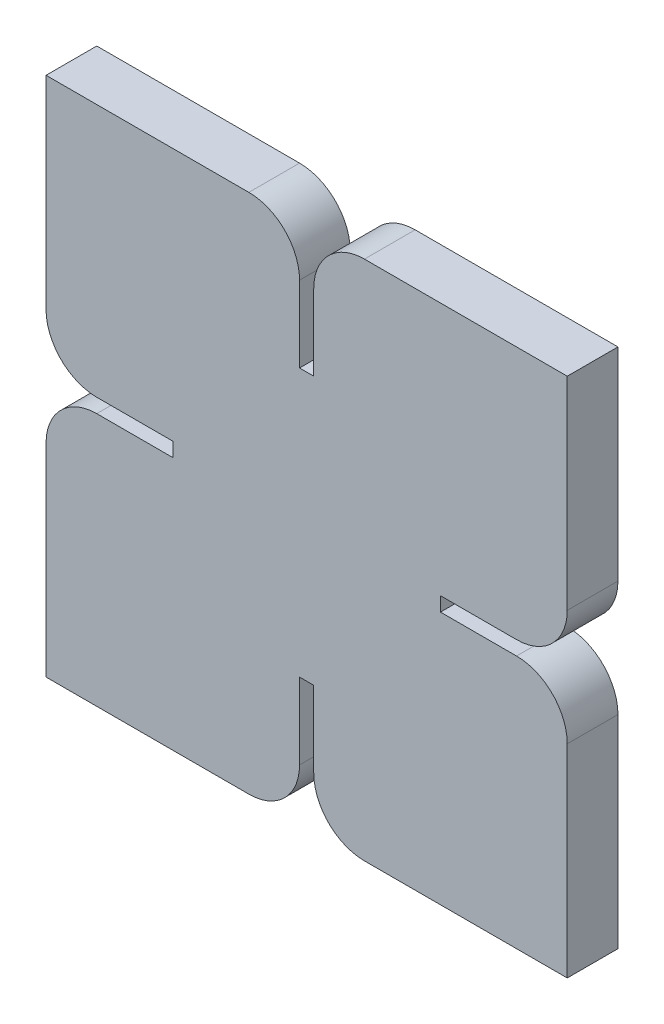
SolidWorks part; units mm, degrees
ref_plane "Front Plane" through (0, 0, 0) normal (0, 0, 1) x (1, 0, 0)
ref_plane "Top Plane" through (0, 0, 0) normal (0, 1, 0) x (1, 0, 0)
ref_plane "Right Plane" through (0, 0, 0) normal (1, 0, 0) x (0, 0, -1)
sketch "Sketch1" plane through (0, 0, 0) normal (0, 0, 1) x (1, 0, 0)
  line L0 (0, 56.5994) -> (0, -33.9185) construction
  line L1 (1.4, 26.4) -> (1.4, 41.4)
  line L2 (-26.4, 1.4) -> (-26.4, -1.4)
  line L3 (-1.4, 26.4) -> (1.4, 26.4)
  line L4 (51.4, 51.4) -> (11.4, 51.4)
  line L5 (51.4, 11.4) -> (51.4, 51.4)
  line L6 (41.4, 1.4) -> (26.4, 1.4)
  line L7 (-41.4, 1.4) -> (-26.4, 1.4)
  line L8 (-51.4, 11.4) -> (-51.4, 51.4)
  line L9 (-51.4, 51.4) -> (-11.4, 51.4)
  line L10 (-1.4, 26.4) -> (-1.4, 41.4)
  line L11 (26.4, 1.4) -> (26.4, -1.4)
  line L12 (-1.4, -26.4) -> (-1.4, -41.4)
  line L13 (-51.4, -51.4) -> (-11.4, -51.4)
  line L14 (-51.4, -11.4) -> (-51.4, -51.4)
  line L15 (-41.4, -1.4) -> (-26.4, -1.4)
  line L16 (41.4, -1.4) -> (26.4, -1.4)
  line L17 (51.4, -11.4) -> (51.4, -51.4)
  line L18 (51.4, -51.4) -> (11.4, -51.4)
  line L19 (-47.3502, 0) -> (63.8446, 0) construction
  line L20 (-1.4, -26.4) -> (1.4, -26.4)
  line L21 (1.4, -26.4) -> (1.4, -41.4)
  arc A0 (-1.4, 41.4) -> (-11.4, 51.4) centre (-11.4, 41.4) ccw
  arc A1 (41.4, 1.4) -> (51.4, 11.4) centre (41.4, 11.4) ccw
  arc A2 (1.4, 41.4) -> (11.4, 51.4) centre (11.4, 41.4) cw
  arc A3 (-41.4, -1.4) -> (-51.4, -11.4) centre (-41.4, -11.4) ccw
  arc A4 (1.4, -41.4) -> (11.4, -51.4) centre (11.4, -41.4) ccw
  arc A5 (41.4, -1.4) -> (51.4, -11.4) centre (41.4, -11.4) cw
  arc A6 (-41.4, 1.4) -> (-51.4, 11.4) centre (-41.4, 11.4) cw
  arc A7 (-1.4, -41.4) -> (-11.4, -51.4) centre (-11.4, -41.4) cw
  point P0 (0, 0)
  point P3 (-1.4, 51.4)
  point P10 (-156.0365, -11.2807)
  point P12 (-156.0365, -11.2807)
  point P13 (-133.044, -4.2512)
  point P18 (-121.9935, -11.2807)
  point P27 (0, 26.4)
  point P29 (51.4, 1.4)
  point P30 (51.4, -1.4)
  point P44 (26.4, 0)
  point P47 (-51.4, -1.4)
  point P50 (-51.4, 1.4)
  point P53 (1.4, 51.4)
  point P54 (-26.4, 0)
  point P55 (1.4, -51.4)
  point P56 (0, -26.4)
  point P57 (-1.4, -51.4)
extrude "Boss-Extrude1" add sketch "Sketch1" along normal blind 10
equation "\"D1@Sketch1\"=\"A\""
equation "\"A\" = 50"
equation "\"D2@Sketch1\"=\"A\""
equation "\"D5@Sketch1\"=\"A\"/5"
equation "\"D3@Sketch1\"=70/\"A\""
equation "\"D7@Sketch1\"=70/\"A\"'"
